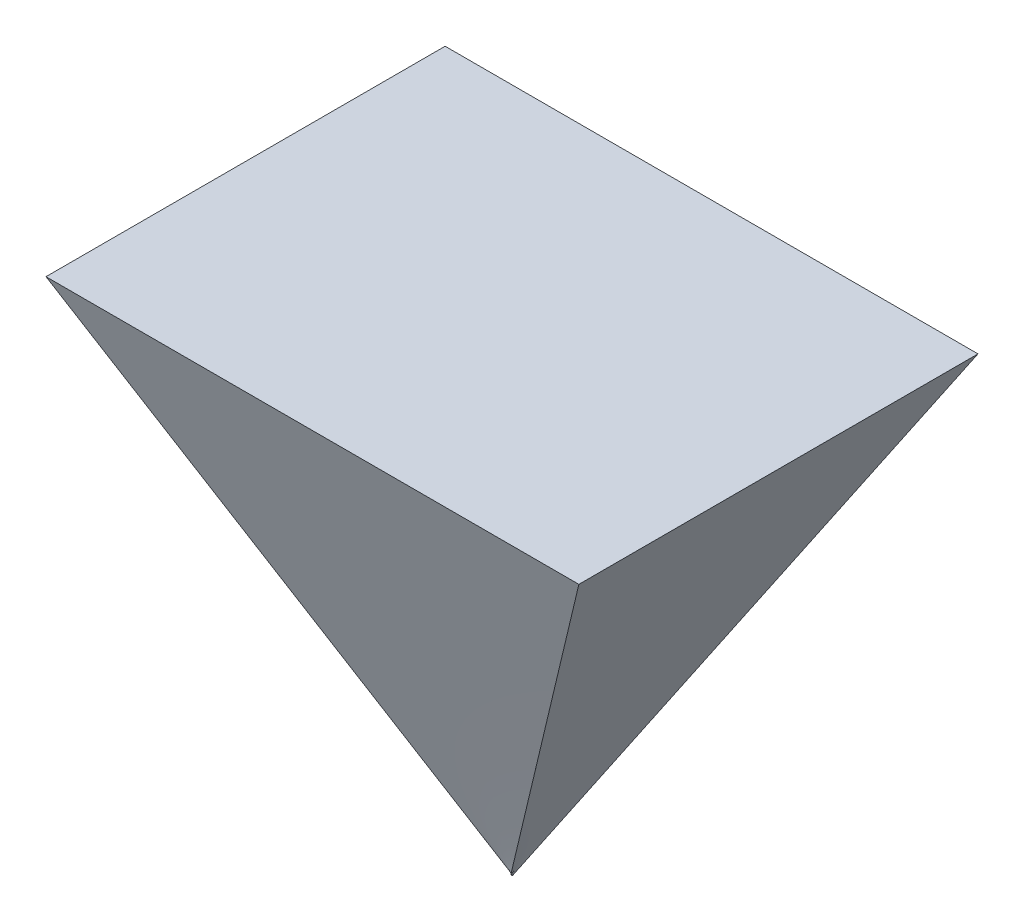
SolidWorks part; units mm, degrees
ref_plane "Front Plane" through (0, 0, 0) normal (0, 0, 1) x (1, 0, 0)
ref_plane "Top Plane" through (0, 0, 0) normal (0, 1, 0) x (1, 0, 0)
ref_plane "Right Plane" through (0, 0, 0) normal (1, 0, 0) x (0, 0, -1)
ref_plane "Plane1" through (0, 2489.2, 0) normal (0, 1, 0) x (-1, 0, 0)
ref_plane "Plane2" through (0, 4978.4, 0) normal (0, 1, 0) x (-1, 0, 0)
sketch "Sketch1" plane through (0, 0, 0) normal (0, 1, 0) x (1, 0, 0)
  line L1 (-6.477, 5.3086) -> (6.477, 5.3086)
  line L2 (-6.477, 5.3086) -> (-6.477, -5.334)
  line L3 (-6.477, -5.334) -> (6.477, -5.334)
  line L4 (6.477, 5.3086) -> (6.477, -5.334)
  dimension "D1" = 10.6426
  dimension "D2" = 12.954
  dimension "D3" = 5.334
  dimension "D4" = 6.477
sketch "Sketch2" plane through (0, 2489.2, 0) normal (0, 1, 0) x (-1, 0, 0)
  line L1 (-1468.12, 1181.1) -> (1452.88, 1181.1)
  line L2 (-1468.12, 1181.1) -> (-1468.12, -1168.4)
  line L3 (-1468.12, -1168.4) -> (1452.88, -1168.4)
  line L4 (1452.88, 1181.1) -> (1452.88, -1168.4)
  dimension "D1" = 2349.5
  dimension "D2" = 2921
  dimension "D3" = 1468.12
  dimension "D4" = 1168.4
sketch "Sketch5" plane through (0, 4978.4, 0) normal (0, 1, 0) x (-1, 0, 0)
  line L1 (-1943.1, 1498.6) -> (1943.1, 1498.6)
  line L2 (-1943.1, 1498.6) -> (-1943.1, -1498.6)
  line L3 (-1943.1, -1498.6) -> (1943.1, -1498.6)
  line L4 (1943.1, 1498.6) -> (1943.1, -1498.6)
  dimension "D1" = 3886.2
  dimension "D2" = 2997.2
  dimension "D3" = 1498.6
  dimension "D4" = 1943.1
loft "Loft7" add profiles "Sketch1", "Sketch5"
sketch "Sketch6" plane through (0, 4978.4, 0) normal (0, 1, 0) x (-1, 0, 0)
  line L1 (-2735, 2050) -> (2738.83, 2050)
  line L2 (-2735, 2050) -> (-2735, -2050)
  line L3 (-2735, -2050) -> (2738.83, -2050)
  line L4 (2738.83, 2050) -> (2738.83, -2050)
  dimension "D1" = 5473.83
  dimension "D2" = 4100
  dimension "D3" = 2050
  dimension "D4" = 2735
sketch "Sketch7" plane through (0, 0, 0) normal (0, 1, 0) x (1, 0, 0)
  line L1 (-8.4817, 6.3478) -> (7.5102, 6.3478)
  line L2 (-8.4817, 6.3478) -> (-8.4817, -6.236)
  line L3 (-8.4817, -6.236) -> (7.5102, -6.236)
  line L4 (7.5102, 6.3478) -> (7.5102, -6.236)
loft "Loft8" add profiles "Sketch7", "Sketch6"
